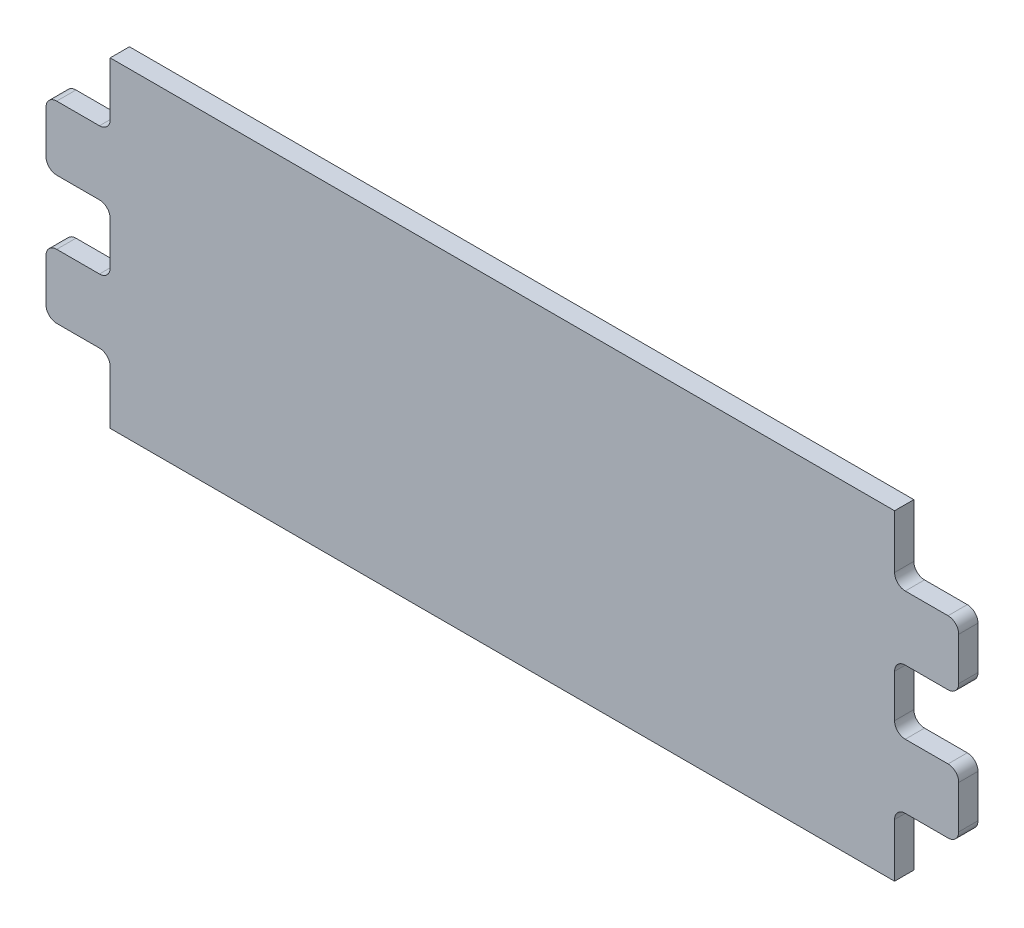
SolidWorks part; units mm, degrees
ref_plane "Plan de face" through (0, 0, 0) normal (0, 0, 1) x (1, 0, 0)
ref_plane "Plan de dessus" through (0, 0, 0) normal (0, 1, 0) x (1, 0, 0)
ref_plane "Plan de droite" through (0, 0, 0) normal (1, 0, 0) x (0, 0, -1)
sketch "Esquisse1" plane through (0, 0, 0) normal (0, 0, 1) x (1, 0, 0)
  line L1 (-850, -250) -> (850, -250)
  line L3 (-850, 250) -> (850, 250)
  arc A0 (-850, 250) -> (-850, -250) centre (-850, 0) ccw
  arc A1 (850, -250) -> (850, 250) centre (850, 0) ccw
  point P0 (0, 0)
  dimension "D3" = 500
  dimension "D5" = 500
extrude "Boss.-Extru.1" add sketch "Esquisse1" along normal blind 18
sketch "Esquisse2" plane through (0, 0, 18) normal (0, 0, 1) x (1, 0, 0)
  line L0 (850, 250) -> (750, 250) construction
  line L1 (850, 250) -> (-850, 250) construction
  line L2 (-850, 250) -> (-750, 250) construction
  line L3 (-750, 250) -> (-750, 50)
  line L4 (-750, 50) -> (750, 50)
  line L5 (750, 50) -> (750, 250)
  dimension "D1" = 100
  dimension "D2" = 100
  dimension "D3" = 200
extrude "Enlèv. mat.-Extru.1" cut sketch "Esquisse2" against normal blind 18 and the other way through all
sketch "Esquisse4" plane through (0, 0, 0) normal (0, 0, -1) x (-1, 0, 0)
  line L0 (-366.6667, -250) -> (-366.6667, 272.5751) construction
  line L1 (850, -250) -> (-850, -250) construction
  line L2 (366.6633, -250) -> (366.6633, 272.5751) construction
  dimension "D2" = 733.33
sketch "Esquisse5" plane through (0, 0, 0) normal (0, 0, -1) x (-1, 0, 0)
  line L0 (-366.6667, 50) -> (-366.6667, -10)
  line L1 (-366.6667, -250) -> (-366.6667, 272.5751) construction
  line L2 (750, 50) -> (-750, 50) construction
  line L3 (-366.6667, -10) -> (-426.6667, -10)
  line L4 (-426.6667, -10) -> (-426.6667, -70)
  line L5 (-426.6667, -70) -> (-366.6667, -70)
  line L6 (-366.6667, -70) -> (-366.6667, -130)
  line L7 (-366.6667, -130) -> (-426.6667, -130)
  line L8 (-426.6667, -130) -> (-426.6667, -190)
  line L9 (-426.6667, -190) -> (-366.6667, -190)
  line L10 (-366.6667, -190) -> (-366.6667, -250)
  line L12 (0, 50) -> (0, -445.9359) construction
  line L13 (366.6667, -190) -> (366.6667, -250)
  line L14 (426.6667, -190) -> (366.6667, -190)
  line L15 (426.6667, -130) -> (426.6667, -190)
  line L16 (366.6667, -130) -> (426.6667, -130)
  line L17 (366.6667, -70) -> (366.6667, -130)
  line L18 (426.6667, -70) -> (366.6667, -70)
  line L19 (426.6667, -10) -> (426.6667, -70)
  line L20 (366.6667, -10) -> (426.6667, -10)
  line L21 (366.6667, 50) -> (366.6667, -10)
  line L22 (-366.6667, 50) -> (-750, 50)
  line L23 (-750, 50) -> (-750, 250)
  line L24 (-750, 250) -> (-850, 250)
  line L25 (-850, -250) -> (-366.6667, -250)
  line L26 (-366.6667, 50) -> (366.6667, 50)
  line L27 (-366.6667, -250) -> (366.6667, -250)
  line L28 (-366.6667, 50) -> (366.6667, 50)
  line L29 (-366.6667, -250) -> (366.6667, -250)
  arc A1 (-850, 250) -> (-850, -250) centre (-850, 0) ccw
  dimension "D1" = 60
extrude "Enlèv. mat.-Extru.2" cut sketch "Esquisse5" against normal blind 30 contours L21 L20 L19 L18 L17 L16 L15 L14 L13 M11 M15 M16 M17 M18 | L25 L10 L9 L8 L7 L6 L5 L4 L3 L0 L22 L23 L24 A1
fillet "Congé2" radius 10 4 edges at (426.6667, -190, 9) (426.6667, -130, 9) (426.6667, -70, 9) (426.6667, -10, 9)
fillet "Congé3" radius 10 12 edges at (-366.6667, -10, 9) (-426.6667, -10, 9) (-426.6667, -70, 9) (-366.6667, -70, 9) (-366.6667, -130, 9) (-426.6667, -130, 9) (-426.6667, -190, 9) (-366.6667, -190, 9) (366.6667, -190, 9) (366.6667, -130, 9) (366.6667, -70, 9) (366.6667, -10, 9)
sketch "Esquisse6" plane through (0, 0, 0) normal (0, 0, -1) x (-1, 0, 0)
  line L0 (-396.6667, -10) -> (-396.6667, -70) construction
  line L1 (-376.6667, -10) -> (-416.6667, -10) construction
  line L2 (-416.6667, -70) -> (-376.6667, -70) construction
  line L3 (-426.6667, -40) -> (-366.6667, -40) construction
  line L8 (-426.6667, -20) -> (-426.6667, -60) construction
  line L9 (-366.6667, -250) -> (-366.6667, 272.5751) construction
  line L10 (-403.5453, -28.1213) -> (-405.6667, -28.1213) construction
  line L17 (-401.424, -54) -> (-391.9093, -54)
  line L18 (-405.6667, -49.7574) -> (-405.6667, -30.2426)
  line L20 (-387.6667, -49.7574) -> (-387.6667, -30.2426)
  line L21 (-405.6667, -54) -> (-387.6667, -26) construction
  line L22 (-405.6667, -26) -> (-387.6667, -54) construction
  line L23 (-405.6667, -28.1213) -> (-403.5453, -28.1213) construction
  line L24 (-403.5453, -28.1213) -> (-403.5453, -26) construction
  line L25 (-401.424, -26) -> (-391.9093, -26)
  arc A8 (-401.424, -26) -> (-405.6667, -30.2426) centre (-403.5453, -28.1213) ccw
  arc A9 (-391.9093, -54) -> (-387.6667, -49.7574) centre (-389.788, -51.8787) ccw
  arc A10 (-401.424, -54) -> (-405.6667, -49.7574) centre (-403.5453, -51.8787) cw
  arc A11 (-391.9093, -26) -> (-387.6667, -30.2426) centre (-389.788, -28.1213) cw
  point P12 (-396.6667, -40)
  point P27 (-396.6667, -40)
  dimension "D3" = 6
  dimension "D1" = 18
  dimension "D2" = 28
  dimension "D4" = 2
extrude "Enlèv. mat.-Extru.3" cut sketch "Esquisse6" against normal blind 9
sketch "Esquisse7" plane through (0, 0, 0) normal (0, 0, -1) x (-1, 0, 0)
  line L0 (366.6667, 50) -> (-366.6667, 50) construction
  line L1 (-314.2957, 50) -> (494.5014, 50)
  line L2 (-314.2957, 50) -> (-314.2957, -280.3051)
  line L3 (-314.2957, -280.3051) -> (494.5014, -280.3051)
  line L4 (494.5014, 50) -> (494.5014, -280.3051)
sketch "Esquisse8" plane through (0, 0, 0) normal (0, 0, -1) x (-1, 0, 0)
  line L0 (396.6667, -190) -> (396.6667, -130) construction
  line L1 (416.6667, -190) -> (376.6667, -190) construction
  line L2 (376.6667, -130) -> (416.6667, -130) construction
  line L3 (-396.6667, -190) -> (-396.6667, -130) construction
  line L4 (-416.6667, -190) -> (-376.6667, -190) construction
  line L5 (-376.6667, -130) -> (-416.6667, -130) construction
pattern_linear "Répétition linéaire2" count 2 spacing 793.33 along (-1, 0, 0) count 2 spacing 120 along (0, -1, 0) of "Enlèv. mat.-Extru.3"
